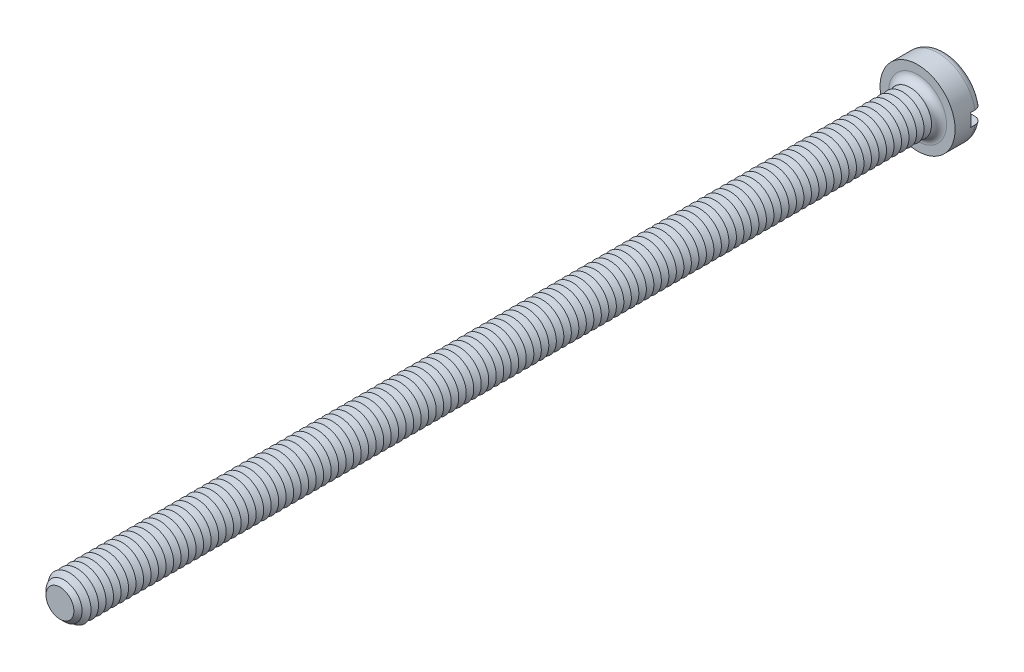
SolidWorks part; units mm, degrees
ref_plane "Front Plane" through (0, 0, 0) normal (0, 0, 1) x (1, 0, 0)
ref_plane "Top Plane" through (0, 0, 0) normal (0, 1, 0) x (1, 0, 0)
ref_plane "Right Plane" through (0, 0, 0) normal (1, 0, 0) x (0, 0, -1)
sketch "Sketch3" plane through (0, 0, 0) normal (0, 0, 1) x (1, 0, 0)
  circle A0 centre (0, 0) radius 3.5
  dimension "D1" = 7
extrude "Boss-Extrude2" add sketch "Sketch3" against normal blind 2.6
sketch "Sketch4" plane through (0, 0, 0) normal (0, 0, 1) x (1, 0, 0)
  circle A0 centre (0, 0) radius 2
  dimension "D1" = 4
extrude "Boss-Extrude3" add sketch "Sketch4" along normal blind 80
fillet "Fillet1" radius 0.7 2 edges at (3.5, 0, -2.6) (2, 0, 0)
chamfer "Chamfer1" distance 0.7 angle 45 1 edges at (2, 0, 80)
sketch "Sketch5" plane through (0, 0, 0) normal (1, 0, 0) x (0, 0, -1)
  line L0 (1.6944, 0) -> (-7.6738, 0) construction
sketch "Sketch6" plane through (0, 0, 0) normal (1, 0, 0) x (0, 0, -1)
  line L0 (-0.7, 2) -> (-1.05, 1.3938)
  line L1 (-1.05, 1.3938) -> (-1.4, 2)
  line L2 (-0.7, 2) -> (-79.3, 2) construction
  line L3 (-1.4, 2) -> (-0.7, 2)
  dimension "D1" = 0.7
revolve "Cut-Revolve1" cut sketch "Sketch6" angle 360 about L0
pattern_linear "LPattern1" count 113 spacing 0.7 along (0, 0, 1) of "Cut-Revolve1"
sketch "Sketch8" plane through (0, 0, -2.6) normal (0, 0, -1) x (-1, 0, 0)
  line L1 (3.5, -0.6) -> (-3.5, -0.6)
  line L2 (3.5, -0.6) -> (3.5, 0.6)
  line L3 (3.5, 0.6) -> (-3.5, 0.6)
  line L4 (-3.5, -0.6) -> (-3.5, 0.6)
  line L5 (3.5, -0.6) -> (-3.5, 0.6) construction
  line L6 (3.5, 0.6) -> (-3.5, -0.6) construction
  point P0 (0, 0)
  dimension "D1" = 7
  dimension "D2" = 1.2
extrude "Cut-Extrude1" cut sketch "Sketch8" against normal blind 1.1
